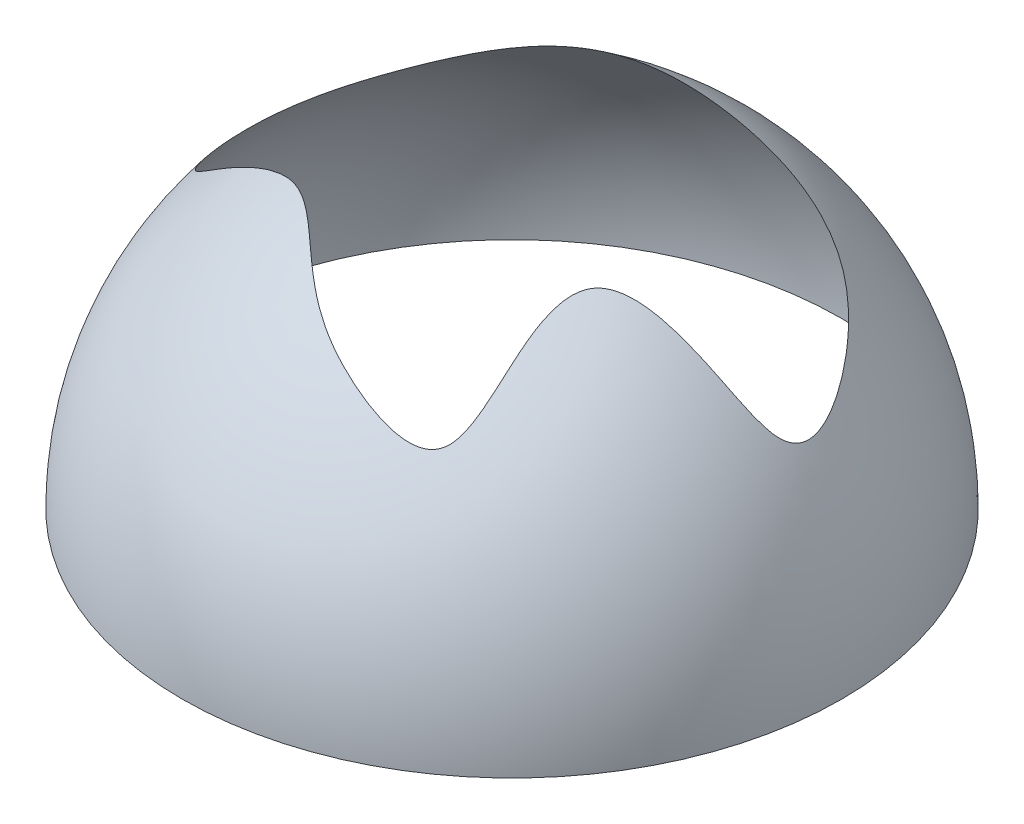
SolidWorks part; units mm, degrees
ref_plane "Front" through (0, 0, 0) normal (0, 0, 1) x (1, 0, 0)
ref_plane "Top" through (0, 0, 0) normal (0, 1, 0) x (1, 0, 0)
ref_plane "Right" through (0, 0, 0) normal (1, 0, 0) x (0, 0, -1)
sketch "Sketch1" plane through (0, 0, 0) normal (0, 0, 1) x (1, 0, 0)
  line L0 (0, 0) -> (0, 59.6577) construction
  arc A0 (0, 59.6577) -> (59.6577, 0) centre (0, 0) cw
surface "Surface-Revolve1" sketch "Sketch1" parameters "D1"=360
sketch "Sketch2" plane through (0, 0, 0) normal (0, 1, 0) x (1, 0, 0)
  spline_without_curve S0
surface "Surface-Trim1"
